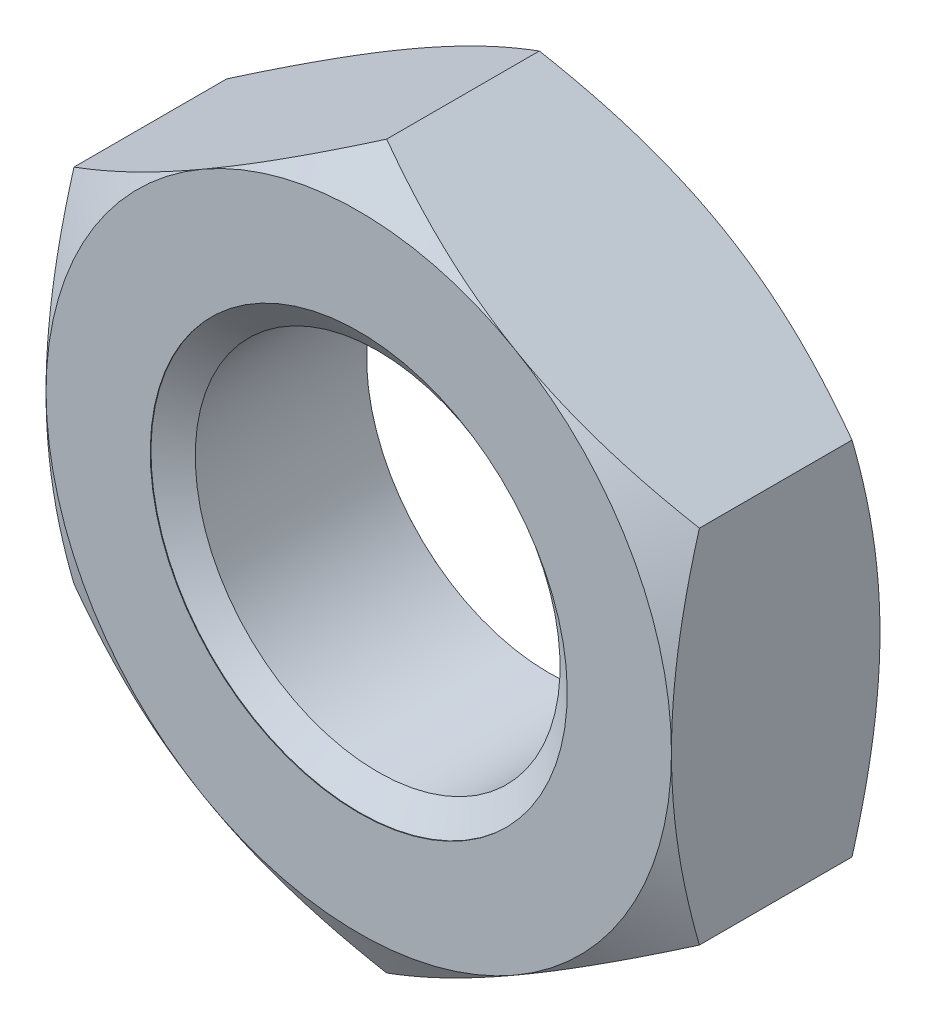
SolidWorks part; units mm, degrees
other "<Ecrou bas Hm M16>-<Ecrou>"
ref_plane "Plan de face" through (0, 0, 0) normal (0, 0, 1) x (1, 0, 0)
ref_plane "Plan de dessus" through (0, 0, 0) normal (0, 1, 0) x (1, 0, 0)
ref_plane "Plan de droite" through (0, 0, 0) normal (1, 0, 0) x (0, 0, -1)
mirrored part "Ecrou bas Hm M16_Symétrique"
